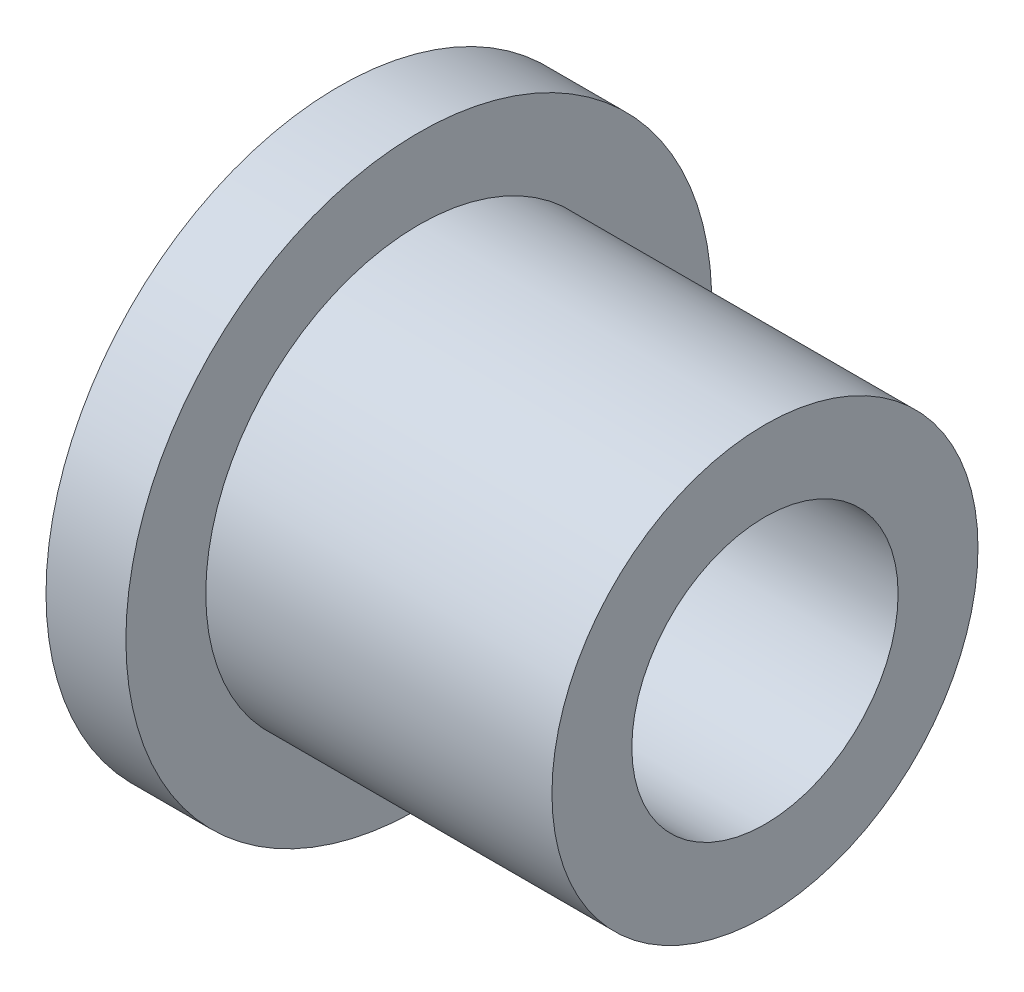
SolidWorks part; units mm, degrees
ref_plane "Plan de face" through (0, 0, 0) normal (0, 0, 1) x (1, 0, 0)
ref_plane "Plan de dessus" through (0, 0, 0) normal (0, 1, 0) x (1, 0, 0)
ref_plane "Plan de droite" through (0, 0, 0) normal (1, 0, 0) x (0, 0, -1)
ref_axis "Axe1" through (-88.99, 0, 0) along (1, 0, 0)
sketch "Esquisse1" plane through (0, 0, 0) normal (0, 0, 1) x (1, 0, 0)
  line L0 (0, 11) -> (0, 5)
  line L1 (0, 5) -> (16, 5)
  line L2 (16, 5) -> (16, 8)
  line L3 (16, 8) -> (3, 8)
  line L4 (3, 8) -> (3, 11)
  line L5 (3, 11) -> (0, 11)
  dimension "D1" = 5
  dimension "D2" = 8
  dimension "D3" = 16
  dimension "D4" = 11
  dimension "D5" = 3
revolve "Révolution1" add sketch "Esquisse1" angle 360 about axis through (-88.99, 0, 0) along (1, 0, 0)
